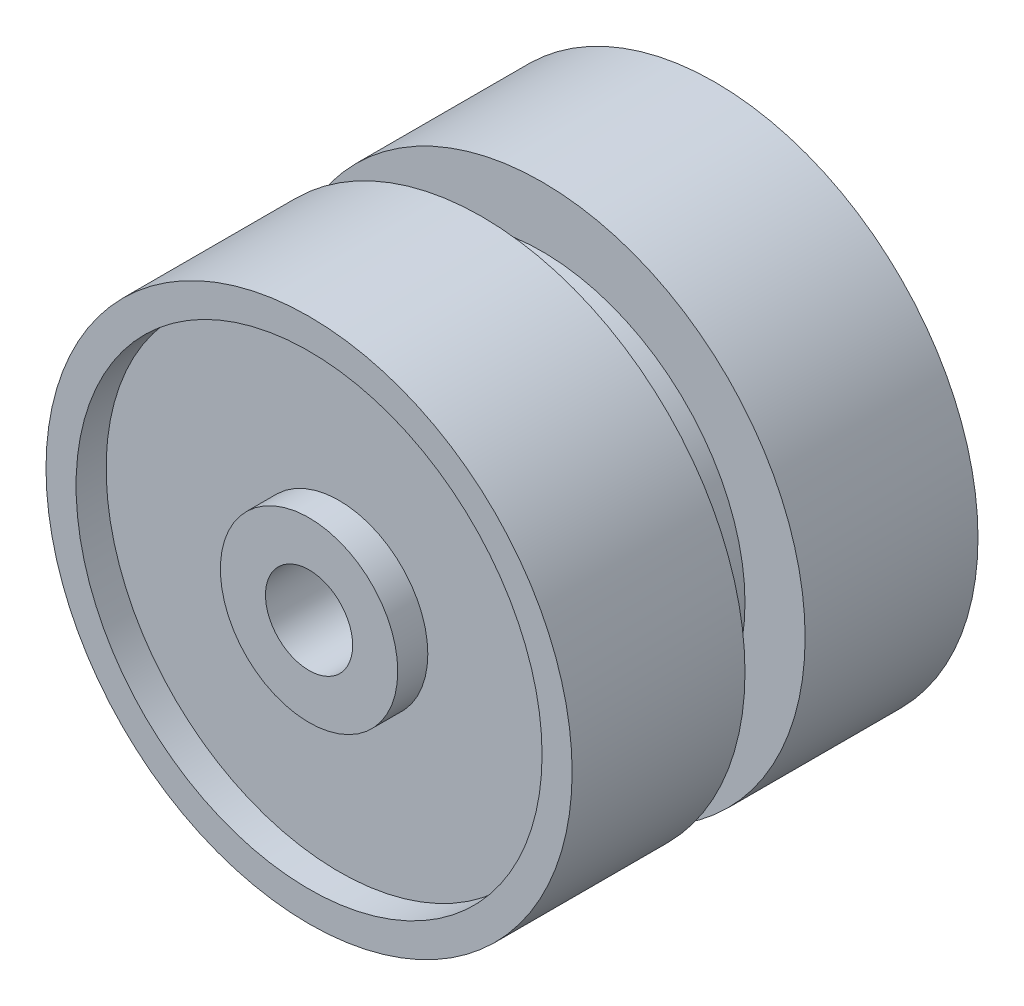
SolidWorks part; units mm, degrees
ref_plane "Plan de face" through (0, 0, 0) normal (0, 0, 1) x (1, 0, 0)
ref_plane "Plan de dessus" through (0, 0, 0) normal (0, 1, 0) x (1, 0, 0)
ref_plane "Plan de droite" through (0, 0, 0) normal (1, 0, 0) x (0, 0, -1)
sketch "Esquisse2" plane through (0, 0, 0) normal (1, 0, 0) x (0, 0, -1)
  line L0 (-6.75, 8.75) -> (-6.75, 1.45)
  line L1 (-6.75, 1.45) -> (6.75, 1.45)
  line L2 (6.75, 1.45) -> (6.75, 8.75)
  line L3 (6.75, 8.75) -> (1, 8.75)
  line L4 (1, 8.75) -> (1, 6.75)
  line L5 (1, 6.75) -> (-1, 6.75)
  line L6 (-1, 6.75) -> (-1, 8.75)
  line L7 (-1, 8.75) -> (-6.75, 8.75)
  line L8 (-15.7878, 0) -> (49984.2122, 0) construction
  dimension "D1" = 2
  dimension "D2" = 2
  dimension "D3" = 13.5
  dimension "D4" = 8.75
  dimension "D5" = 1.45
  dimension "D6" = 6.75
revolve "Révolution1" add sketch "Esquisse2" angle 360 about L8
sketch "Esquisse3" plane through (0, 0, 6.75) normal (0, 0, 1) x (1, 0, 0)
  circle A0 centre (0, 0) radius 7.75
  circle A1 centre (0, 0) radius 2.95
  circle A2 centre (0, 0) radius 1.45 construction
  circle A3 centre (0, 0) radius 8.75 construction
  dimension "D1" = 1.5
  dimension "D2" = 1
extrude "Enlèv. mat.-Extru.1" cut sketch "Esquisse3" against normal blind 1
